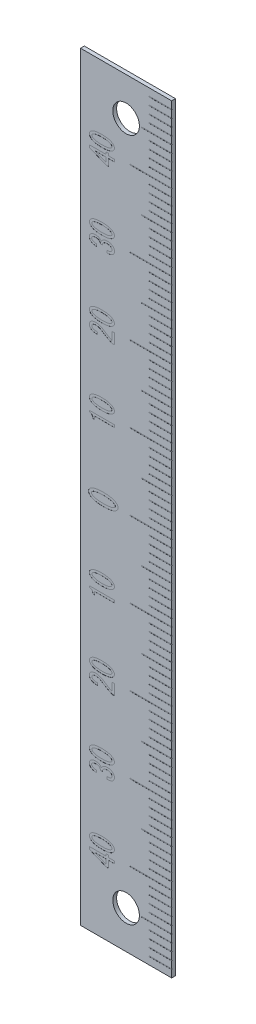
SolidWorks part; units mm, degrees
ref_plane "Front" through (0, 0, 0) normal (0, 0, 1) x (1, 0, 0)
ref_plane "Top" through (0, 0, 0) normal (0, 1, 0) x (1, 0, 0)
ref_plane "Right" through (0, 0, 0) normal (1, 0, 0) x (0, 0, -1)
sketch "Sketch1" plane through (0, 0, 0) normal (0, 0, 1) x (1, 0, 0)
  line L1 (0, 0) -> (0, 100)
  line L2 (0, 0) -> (12, 0)
  line L3 (12, 0) -> (12, 100)
  line L4 (0, 100) -> (12, 100)
  dimension "D1" = 100
  dimension "D2" = 12
extrude "Extrude1" add sketch "Sketch1" along normal blind 0.5
sketch "Sketch2" plane through (0, 0, 0.5) normal (0, 0, 1) x (1, 0, 0)
  line L0 (0, 100) -> (0, 0) construction
  line L1 (0, 0) -> (12, 0) construction
  line L2 (12, 100) -> (0, 100) construction
  circle A0 centre (6, 5) radius 1.75
  circle A1 centre (6, 95) radius 1.75
  dimension "D1" = 6
  dimension "D2" = 6
  dimension "D3" = 5
  dimension "D4" = 5
  dimension "D5" = 3.5
  dimension "D6" = 3.5
extrude "Extrude2" cut sketch "Sketch2" against normal through all
sketch "Sketch3" plane through (0, 0, 0.5) normal (0, 0, 1) x (1, 0, 0)
  line L0 (12, 100) -> (0, 100) construction
  line L1 (1, 88.25) -> (4.5, 88.25) construction
  line L2 (1, 88.25) -> (1, 91.75) construction
  line L3 (1, 91.75) -> (4.5, 91.75) construction
  line L4 (4.5, 88.25) -> (4.5, 91.75) construction
  line L5 (0, 100) -> (0, 0) construction
  line L6 (4.5, 78.25) -> (4.5, 81.75) construction
  line L7 (4.5, 68.25) -> (4.5, 71.75) construction
  line L8 (4.5, 58.25) -> (4.5, 61.75) construction
  line L9 (5, 49.125) -> (5, 52.625) construction
  line L10 (4.5, 38.25) -> (4.5, 41.75) construction
  line L11 (4.5, 28.25) -> (4.5, 31.75) construction
  line L12 (4.5, 18.25) -> (4.5, 21.75) construction
  line L13 (4.5, 8.25) -> (4.5, 11.75) construction
  line L14 (8.2751, 50) -> (-8.2751, 50) construction
  line L15 (8.2751, 40) -> (-8.2751, 40) construction
  line L16 (12, 0) -> (12, 100) construction
  line L17 (8.2751, 30) -> (-8.2751, 30) construction
  line L18 (8.2751, 20) -> (-8.2751, 20) construction
  line L19 (8.2751, 10) -> (-8.2751, 10) construction
  line L20 (8.2751, 60) -> (-8.2751, 60) construction
  line L21 (8.2751, 70) -> (-8.2751, 70) construction
  line L22 (8.2751, 80) -> (-8.2751, 80) construction
  line L23 (8.2751, 90) -> (-8.2751, 90) construction
  text T0 "40" font "ＭＳ ゴシック" height in points 11
  text T1 "30" font "ＭＳ ゴシック" height in points 11
  text T2 "20" font "ＭＳ ゴシック" height in points 11
  text T3 "10" font "ＭＳ ゴシック" height in points 11
  text T4 "0" font "ＭＳ ゴシック" height in points 13
  text T5 "10  " font "ＭＳ ゴシック" height in points 11
  text T6 "20" font "ＭＳ ゴシック" height in points 11
  text T7 "30" font "ＭＳ ゴシック" height in points 11
  text T8 "40" font "ＭＳ ゴシック" height in points 11
  point P4 (4.5, 90)
  point P36 (0, 50)
  dimension "D1" = 3.5
  dimension "D2" = 10
  dimension "D3" = 1
  dimension "D4" = 3.5
  dimension "D7" = 5
  dimension "D9" = 0.875
  dimension "D6" = 7
  dimension "D5" = 4
  dimension "D8" = 5
extrude "Extrude3" cut sketch "Sketch3" against normal blind 0.01
sketch "Sketch4" plane through (0, 0, 0.5) normal (0, 0, 1) x (1, 0, 0)
  line L0 (12, 90.05) -> (6.5, 90.05)
  line L1 (12, 0) -> (12, 100) construction
  line L2 (6.5, 90.05) -> (6.5, 89.95)
  line L3 (6.5, 89.95) -> (12, 89.95)
  line L4 (12, 89.95) -> (12, 90.05)
  line L5 (12, 100) -> (0, 100) construction
  line L6 (12, 98.05) -> (12, 97.95)
  line L7 (12, 94.95) -> (8, 94.95)
  line L8 (12, 94.95) -> (12, 95.05)
  line L9 (12, 95.05) -> (8, 95.05)
  line L10 (8, 94.95) -> (8, 95.05)
  line L11 (12, 99.05) -> (9, 99.05)
  line L12 (12, 99.05) -> (12, 98.95)
  line L13 (12, 98.95) -> (9, 98.95)
  line L14 (9, 99.05) -> (9, 98.95)
  line L15 (12, 98.05) -> (9, 98.05)
  line L16 (12, 97.95) -> (9, 97.95)
  line L17 (9, 98.05) -> (9, 97.95)
  line L18 (12, 97.05) -> (12, 96.95)
  line L19 (12, 97.05) -> (9, 97.05)
  line L20 (12, 96.95) -> (9, 96.95)
  line L21 (9, 97.05) -> (9, 96.95)
  line L22 (12, 96.05) -> (12, 95.95)
  line L23 (12, 96.05) -> (9, 96.05)
  line L24 (12, 95.95) -> (9, 95.95)
  line L25 (9, 96.05) -> (9, 95.95)
  line L26 (12, 80.05) -> (6.5, 80.05)
  line L27 (6.5, 80.05) -> (6.5, 79.95)
  line L28 (6.5, 79.95) -> (12, 79.95)
  line L29 (12, 79.95) -> (12, 80.05)
  line L30 (12, 94.05) -> (12, 93.95)
  line L31 (12, 94.05) -> (9, 94.05)
  line L32 (12, 93.95) -> (9, 93.95)
  line L33 (9, 94.05) -> (9, 93.95)
  line L34 (12, 93.05) -> (12, 92.95)
  line L35 (12, 93.05) -> (9, 93.05)
  line L36 (12, 92.95) -> (9, 92.95)
  line L37 (9, 93.05) -> (9, 92.95)
  line L38 (12, 92.05) -> (12, 91.95)
  line L39 (12, 92.05) -> (9, 92.05)
  line L40 (12, 91.95) -> (9, 91.95)
  line L41 (9, 92.05) -> (9, 91.95)
  line L42 (12, 91.05) -> (12, 90.95)
  line L43 (12, 91.05) -> (9, 91.05)
  line L44 (12, 90.95) -> (9, 90.95)
  line L45 (9, 91.05) -> (9, 90.95)
  line L46 (9, 95.05) -> (9, 94.95)
  line L47 (12, 95.05) -> (9, 95.05)
  line L48 (12, 94.95) -> (9, 94.95)
  line L49 (12, 95.05) -> (12, 94.95)
  line L50 (12, 88.05) -> (12, 87.95)
  line L51 (12, 84.95) -> (8, 84.95)
  line L52 (12, 84.95) -> (12, 85.05)
  line L53 (12, 85.05) -> (8, 85.05)
  line L54 (8, 84.95) -> (8, 85.05)
  line L55 (12, 89.05) -> (9, 89.05)
  line L56 (12, 89.05) -> (12, 88.95)
  line L57 (12, 88.95) -> (9, 88.95)
  line L58 (9, 89.05) -> (9, 88.95)
  line L59 (12, 88.05) -> (9, 88.05)
  line L60 (12, 87.95) -> (9, 87.95)
  line L61 (9, 88.05) -> (9, 87.95)
  line L62 (12, 87.05) -> (12, 86.95)
  line L63 (12, 87.05) -> (9, 87.05)
  line L64 (12, 86.95) -> (9, 86.95)
  line L65 (9, 87.05) -> (9, 86.95)
  line L66 (12, 86.05) -> (12, 85.95)
  line L67 (12, 86.05) -> (9, 86.05)
  line L68 (12, 85.95) -> (9, 85.95)
  line L69 (9, 86.05) -> (9, 85.95)
  line L70 (12, 84.05) -> (12, 83.95)
  line L71 (12, 84.05) -> (9, 84.05)
  line L72 (12, 83.95) -> (9, 83.95)
  line L73 (9, 84.05) -> (9, 83.95)
  line L74 (12, 83.05) -> (12, 82.95)
  line L75 (12, 83.05) -> (9, 83.05)
  line L76 (12, 82.95) -> (9, 82.95)
  line L77 (9, 83.05) -> (9, 82.95)
  line L78 (12, 82.05) -> (12, 81.95)
  line L79 (12, 82.05) -> (9, 82.05)
  line L80 (12, 81.95) -> (9, 81.95)
  line L81 (9, 82.05) -> (9, 81.95)
  line L82 (12, 81.05) -> (12, 80.95)
  line L83 (12, 81.05) -> (9, 81.05)
  line L84 (12, 80.95) -> (9, 80.95)
  line L85 (9, 81.05) -> (9, 80.95)
  line L86 (12, 70.05) -> (6.5, 70.05)
  line L87 (6.5, 70.05) -> (6.5, 69.95)
  line L88 (6.5, 69.95) -> (12, 69.95)
  line L89 (12, 69.95) -> (12, 70.05)
  line L90 (12, 78.05) -> (12, 77.95)
  line L91 (12, 74.95) -> (8, 74.95)
  line L92 (12, 74.95) -> (12, 75.05)
  line L93 (12, 75.05) -> (8, 75.05)
  line L94 (8, 74.95) -> (8, 75.05)
  line L95 (12, 79.05) -> (9, 79.05)
  line L96 (12, 79.05) -> (12, 78.95)
  line L97 (12, 78.95) -> (9, 78.95)
  line L98 (9, 79.05) -> (9, 78.95)
  line L99 (12, 78.05) -> (9, 78.05)
  line L100 (12, 77.95) -> (9, 77.95)
  line L101 (9, 78.05) -> (9, 77.95)
  line L102 (12, 77.05) -> (12, 76.95)
  line L103 (12, 77.05) -> (9, 77.05)
  line L104 (12, 76.95) -> (9, 76.95)
  line L105 (9, 77.05) -> (9, 76.95)
  line L106 (12, 76.05) -> (12, 75.95)
  line L107 (12, 76.05) -> (9, 76.05)
  line L108 (12, 75.95) -> (9, 75.95)
  line L109 (9, 76.05) -> (9, 75.95)
  line L110 (12, 74.05) -> (12, 73.95)
  line L111 (12, 74.05) -> (9, 74.05)
  line L112 (12, 73.95) -> (9, 73.95)
  line L113 (9, 74.05) -> (9, 73.95)
  line L114 (12, 73.05) -> (12, 72.95)
  line L115 (12, 73.05) -> (9, 73.05)
  line L116 (12, 72.95) -> (9, 72.95)
  line L117 (9, 73.05) -> (9, 72.95)
  line L118 (12, 72.05) -> (12, 71.95)
  line L119 (12, 72.05) -> (9, 72.05)
  line L120 (12, 71.95) -> (9, 71.95)
  line L121 (9, 72.05) -> (9, 71.95)
  line L122 (12, 71.05) -> (12, 70.95)
  line L123 (12, 71.05) -> (9, 71.05)
  line L124 (12, 70.95) -> (9, 70.95)
  line L125 (9, 71.05) -> (9, 70.95)
  line L126 (12, 60.05) -> (6.5, 60.05)
  line L127 (6.5, 60.05) -> (6.5, 59.95)
  line L128 (6.5, 59.95) -> (12, 59.95)
  line L129 (12, 59.95) -> (12, 60.05)
  line L130 (12, 68.05) -> (12, 67.95)
  line L131 (12, 64.95) -> (8, 64.95)
  line L132 (12, 64.95) -> (12, 65.05)
  line L133 (12, 65.05) -> (8, 65.05)
  line L134 (8, 64.95) -> (8, 65.05)
  line L135 (12, 69.05) -> (9, 69.05)
  line L136 (12, 69.05) -> (12, 68.95)
  line L137 (12, 68.95) -> (9, 68.95)
  line L138 (9, 69.05) -> (9, 68.95)
  line L139 (12, 68.05) -> (9, 68.05)
  line L140 (12, 67.95) -> (9, 67.95)
  line L141 (9, 68.05) -> (9, 67.95)
  line L142 (12, 67.05) -> (12, 66.95)
  line L143 (12, 67.05) -> (9, 67.05)
  line L144 (12, 66.95) -> (9, 66.95)
  line L145 (9, 67.05) -> (9, 66.95)
  line L146 (12, 66.05) -> (12, 65.95)
  line L147 (12, 66.05) -> (9, 66.05)
  line L148 (12, 65.95) -> (9, 65.95)
  line L149 (9, 66.05) -> (9, 65.95)
  line L150 (12, 64.05) -> (12, 63.95)
  line L151 (12, 64.05) -> (9, 64.05)
  line L152 (12, 63.95) -> (9, 63.95)
  line L153 (9, 64.05) -> (9, 63.95)
  line L154 (12, 63.05) -> (12, 62.95)
  line L155 (12, 63.05) -> (9, 63.05)
  line L156 (12, 62.95) -> (9, 62.95)
  line L157 (9, 63.05) -> (9, 62.95)
  line L158 (12, 62.05) -> (12, 61.95)
  line L159 (12, 62.05) -> (9, 62.05)
  line L160 (12, 61.95) -> (9, 61.95)
  line L161 (9, 62.05) -> (9, 61.95)
  line L162 (12, 61.05) -> (12, 60.95)
  line L163 (12, 61.05) -> (9, 61.05)
  line L164 (12, 60.95) -> (9, 60.95)
  line L165 (9, 61.05) -> (9, 60.95)
  line L166 (12, 50.05) -> (6.5, 50.05)
  line L167 (6.5, 50.05) -> (6.5, 49.95)
  line L168 (6.5, 49.95) -> (12, 49.95)
  line L169 (12, 49.95) -> (12, 50.05)
  line L170 (12, 58.05) -> (12, 57.95)
  line L171 (12, 54.95) -> (8, 54.95)
  line L172 (12, 54.95) -> (12, 55.05)
  line L173 (12, 55.05) -> (8, 55.05)
  line L174 (8, 54.95) -> (8, 55.05)
  line L175 (12, 59.05) -> (9, 59.05)
  line L176 (12, 59.05) -> (12, 58.95)
  line L177 (12, 58.95) -> (9, 58.95)
  line L178 (9, 59.05) -> (9, 58.95)
  line L179 (12, 58.05) -> (9, 58.05)
  line L180 (12, 57.95) -> (9, 57.95)
  line L181 (9, 58.05) -> (9, 57.95)
  line L182 (12, 57.05) -> (12, 56.95)
  line L183 (12, 57.05) -> (9, 57.05)
  line L184 (12, 56.95) -> (9, 56.95)
  line L185 (9, 57.05) -> (9, 56.95)
  line L186 (12, 56.05) -> (12, 55.95)
  line L187 (12, 56.05) -> (9, 56.05)
  line L188 (12, 55.95) -> (9, 55.95)
  line L189 (9, 56.05) -> (9, 55.95)
  line L190 (12, 54.05) -> (12, 53.95)
  line L191 (12, 54.05) -> (9, 54.05)
  line L192 (12, 53.95) -> (9, 53.95)
  line L193 (9, 54.05) -> (9, 53.95)
  line L194 (12, 53.05) -> (12, 52.95)
  line L195 (12, 53.05) -> (9, 53.05)
  line L196 (12, 52.95) -> (9, 52.95)
  line L197 (9, 53.05) -> (9, 52.95)
  line L198 (12, 52.05) -> (12, 51.95)
  line L199 (12, 52.05) -> (9, 52.05)
  line L200 (12, 51.95) -> (9, 51.95)
  line L201 (9, 52.05) -> (9, 51.95)
  line L202 (12, 51.05) -> (12, 50.95)
  line L203 (12, 51.05) -> (9, 51.05)
  line L204 (12, 50.95) -> (9, 50.95)
  line L205 (9, 51.05) -> (9, 50.95)
  line L206 (12, 50.05) -> (6.5, 50.05)
  line L207 (6.5, 50.05) -> (6.5, 49.95)
  line L208 (6.5, 49.95) -> (12, 49.95)
  line L209 (12, 49.95) -> (12, 50.05)
  line L210 (12, 48.05) -> (12, 47.95)
  line L211 (12, 44.95) -> (8, 44.95)
  line L212 (12, 44.95) -> (12, 45.05)
  line L213 (12, 45.05) -> (8, 45.05)
  line L214 (8, 44.95) -> (8, 45.05)
  line L215 (12, 49.05) -> (9, 49.05)
  line L216 (12, 49.05) -> (12, 48.95)
  line L217 (12, 48.95) -> (9, 48.95)
  line L218 (9, 49.05) -> (9, 48.95)
  line L219 (12, 48.05) -> (9, 48.05)
  line L220 (12, 47.95) -> (9, 47.95)
  line L221 (9, 48.05) -> (9, 47.95)
  line L222 (12, 47.05) -> (12, 46.95)
  line L223 (12, 47.05) -> (9, 47.05)
  line L224 (12, 46.95) -> (9, 46.95)
  line L225 (9, 47.05) -> (9, 46.95)
  line L226 (12, 46.05) -> (12, 45.95)
  line L227 (12, 46.05) -> (9, 46.05)
  line L228 (12, 45.95) -> (9, 45.95)
  line L229 (9, 46.05) -> (9, 45.95)
  line L230 (12, 44.05) -> (12, 43.95)
  line L231 (12, 44.05) -> (9, 44.05)
  line L232 (12, 43.95) -> (9, 43.95)
  line L233 (9, 44.05) -> (9, 43.95)
  line L234 (12, 43.05) -> (12, 42.95)
  line L235 (12, 43.05) -> (9, 43.05)
  line L236 (12, 42.95) -> (9, 42.95)
  line L237 (9, 43.05) -> (9, 42.95)
  line L238 (12, 42.05) -> (12, 41.95)
  line L239 (12, 42.05) -> (9, 42.05)
  line L240 (12, 41.95) -> (9, 41.95)
  line L241 (9, 42.05) -> (9, 41.95)
  line L242 (12, 41.05) -> (12, 40.95)
  line L243 (12, 41.05) -> (9, 41.05)
  line L244 (12, 40.95) -> (9, 40.95)
  line L245 (9, 41.05) -> (9, 40.95)
  line L246 (12, 40.05) -> (6.5, 40.05)
  line L247 (6.5, 40.05) -> (6.5, 39.95)
  line L248 (6.5, 39.95) -> (12, 39.95)
  line L249 (12, 39.95) -> (12, 40.05)
  line L250 (12, 38.05) -> (12, 37.95)
  line L251 (12, 34.95) -> (8, 34.95)
  line L252 (12, 34.95) -> (12, 35.05)
  line L253 (12, 35.05) -> (8, 35.05)
  line L254 (8, 34.95) -> (8, 35.05)
  line L255 (12, 39.05) -> (9, 39.05)
  line L256 (12, 39.05) -> (12, 38.95)
  line L257 (12, 38.95) -> (9, 38.95)
  line L258 (9, 39.05) -> (9, 38.95)
  line L259 (12, 38.05) -> (9, 38.05)
  line L260 (12, 37.95) -> (9, 37.95)
  line L261 (9, 38.05) -> (9, 37.95)
  line L262 (12, 37.05) -> (12, 36.95)
  line L263 (12, 37.05) -> (9, 37.05)
  line L264 (12, 36.95) -> (9, 36.95)
  line L265 (9, 37.05) -> (9, 36.95)
  line L266 (12, 36.05) -> (12, 35.95)
  line L267 (12, 36.05) -> (9, 36.05)
  line L268 (12, 35.95) -> (9, 35.95)
  line L269 (9, 36.05) -> (9, 35.95)
  line L270 (12, 34.05) -> (12, 33.95)
  line L271 (12, 34.05) -> (9, 34.05)
  line L272 (12, 33.95) -> (9, 33.95)
  line L273 (9, 34.05) -> (9, 33.95)
  line L274 (12, 33.05) -> (12, 32.95)
  line L275 (12, 33.05) -> (9, 33.05)
  line L276 (12, 32.95) -> (9, 32.95)
  line L277 (9, 33.05) -> (9, 32.95)
  line L278 (12, 32.05) -> (12, 31.95)
  line L279 (12, 32.05) -> (9, 32.05)
  line L280 (12, 31.95) -> (9, 31.95)
  line L281 (9, 32.05) -> (9, 31.95)
  line L282 (12, 31.05) -> (12, 30.95)
  line L283 (12, 31.05) -> (9, 31.05)
  line L284 (12, 30.95) -> (9, 30.95)
  line L285 (9, 31.05) -> (9, 30.95)
  line L286 (12, 30.05) -> (6.5, 30.05)
  line L287 (6.5, 30.05) -> (6.5, 29.95)
  line L288 (6.5, 29.95) -> (12, 29.95)
  line L289 (12, 29.95) -> (12, 30.05)
  line L290 (12, 28.05) -> (12, 27.95)
  line L291 (12, 24.95) -> (8, 24.95)
  line L292 (12, 24.95) -> (12, 25.05)
  line L293 (12, 25.05) -> (8, 25.05)
  line L294 (8, 24.95) -> (8, 25.05)
  line L295 (12, 29.05) -> (9, 29.05)
  line L296 (12, 29.05) -> (12, 28.95)
  line L297 (12, 28.95) -> (9, 28.95)
  line L298 (9, 29.05) -> (9, 28.95)
  line L299 (12, 28.05) -> (9, 28.05)
  line L300 (12, 27.95) -> (9, 27.95)
  line L301 (9, 28.05) -> (9, 27.95)
  line L302 (12, 27.05) -> (12, 26.95)
  line L303 (12, 27.05) -> (9, 27.05)
  line L304 (12, 26.95) -> (9, 26.95)
  line L305 (9, 27.05) -> (9, 26.95)
  line L306 (12, 26.05) -> (12, 25.95)
  line L307 (12, 26.05) -> (9, 26.05)
  line L308 (12, 25.95) -> (9, 25.95)
  line L309 (9, 26.05) -> (9, 25.95)
  line L310 (12, 24.05) -> (12, 23.95)
  line L311 (12, 24.05) -> (9, 24.05)
  line L312 (12, 23.95) -> (9, 23.95)
  line L313 (9, 24.05) -> (9, 23.95)
  line L314 (12, 23.05) -> (12, 22.95)
  line L315 (12, 23.05) -> (9, 23.05)
  line L316 (12, 22.95) -> (9, 22.95)
  line L317 (9, 23.05) -> (9, 22.95)
  line L318 (12, 22.05) -> (12, 21.95)
  line L319 (12, 22.05) -> (9, 22.05)
  line L320 (12, 21.95) -> (9, 21.95)
  line L321 (9, 22.05) -> (9, 21.95)
  line L322 (12, 21.05) -> (12, 20.95)
  line L323 (12, 21.05) -> (9, 21.05)
  line L324 (12, 20.95) -> (9, 20.95)
  line L325 (9, 21.05) -> (9, 20.95)
  line L326 (12, 20.05) -> (6.5, 20.05)
  line L327 (6.5, 20.05) -> (6.5, 19.95)
  line L328 (6.5, 19.95) -> (12, 19.95)
  line L329 (12, 19.95) -> (12, 20.05)
  line L330 (12, 18.05) -> (12, 17.95)
  line L331 (12, 14.95) -> (8, 14.95)
  line L332 (12, 14.95) -> (12, 15.05)
  line L333 (12, 15.05) -> (8, 15.05)
  line L334 (8, 14.95) -> (8, 15.05)
  line L335 (12, 19.05) -> (9, 19.05)
  line L336 (12, 19.05) -> (12, 18.95)
  line L337 (12, 18.95) -> (9, 18.95)
  line L338 (9, 19.05) -> (9, 18.95)
  line L339 (12, 18.05) -> (9, 18.05)
  line L340 (12, 17.95) -> (9, 17.95)
  line L341 (9, 18.05) -> (9, 17.95)
  line L342 (12, 17.05) -> (12, 16.95)
  line L343 (12, 17.05) -> (9, 17.05)
  line L344 (12, 16.95) -> (9, 16.95)
  line L345 (9, 17.05) -> (9, 16.95)
  line L346 (12, 16.05) -> (12, 15.95)
  line L347 (12, 16.05) -> (9, 16.05)
  line L348 (12, 15.95) -> (9, 15.95)
  line L349 (9, 16.05) -> (9, 15.95)
  line L350 (12, 14.05) -> (12, 13.95)
  line L351 (12, 14.05) -> (9, 14.05)
  line L352 (12, 13.95) -> (9, 13.95)
  line L353 (9, 14.05) -> (9, 13.95)
  line L354 (12, 13.05) -> (12, 12.95)
  line L355 (12, 13.05) -> (9, 13.05)
  line L356 (12, 12.95) -> (9, 12.95)
  line L357 (9, 13.05) -> (9, 12.95)
  line L358 (12, 12.05) -> (12, 11.95)
  line L359 (12, 12.05) -> (9, 12.05)
  line L360 (12, 11.95) -> (9, 11.95)
  line L361 (9, 12.05) -> (9, 11.95)
  line L362 (12, 11.05) -> (12, 10.95)
  line L363 (12, 11.05) -> (9, 11.05)
  line L364 (12, 10.95) -> (9, 10.95)
  line L365 (9, 11.05) -> (9, 10.95)
  line L366 (12, 10.05) -> (6.5, 10.05)
  line L367 (6.5, 10.05) -> (6.5, 9.95)
  line L368 (6.5, 9.95) -> (12, 9.95)
  line L369 (12, 9.95) -> (12, 10.05)
  line L370 (12, 8.05) -> (12, 7.95)
  line L371 (12, 4.95) -> (8, 4.95)
  line L372 (12, 4.95) -> (12, 5.05)
  line L373 (12, 5.05) -> (8, 5.05)
  line L374 (8, 4.95) -> (8, 5.05)
  line L375 (12, 9.05) -> (9, 9.05)
  line L376 (12, 9.05) -> (12, 8.95)
  line L377 (12, 8.95) -> (9, 8.95)
  line L378 (9, 9.05) -> (9, 8.95)
  line L379 (12, 8.05) -> (9, 8.05)
  line L380 (12, 7.95) -> (9, 7.95)
  line L381 (9, 8.05) -> (9, 7.95)
  line L382 (12, 7.05) -> (12, 6.95)
  line L383 (12, 7.05) -> (9, 7.05)
  line L384 (12, 6.95) -> (9, 6.95)
  line L385 (9, 7.05) -> (9, 6.95)
  line L386 (12, 6.05) -> (12, 5.95)
  line L387 (12, 6.05) -> (9, 6.05)
  line L388 (12, 5.95) -> (9, 5.95)
  line L389 (9, 6.05) -> (9, 5.95)
  line L390 (12, 4.05) -> (12, 3.95)
  line L391 (12, 4.05) -> (9, 4.05)
  line L392 (12, 3.95) -> (9, 3.95)
  line L393 (9, 4.05) -> (9, 3.95)
  line L394 (12, 3.05) -> (12, 2.95)
  line L395 (12, 3.05) -> (9, 3.05)
  line L396 (12, 2.95) -> (9, 2.95)
  line L397 (9, 3.05) -> (9, 2.95)
  line L398 (12, 2.05) -> (12, 1.95)
  line L399 (12, 2.05) -> (9, 2.05)
  line L400 (12, 1.95) -> (9, 1.95)
  line L401 (9, 2.05) -> (9, 1.95)
  line L402 (12, 1.05) -> (12, 0.95)
  line L403 (12, 1.05) -> (9, 1.05)
  line L404 (12, 0.95) -> (9, 0.95)
  line L405 (9, 1.05) -> (9, 0.95)
  point P4 (12, 90)
  point P13 (12, 95)
  point P18 (12, 99)
  dimension "D1" = 10
  dimension "D2" = 0.1
  dimension "D3" = 5.5
  dimension "D4" = 5
  dimension "D5" = 0.1
  dimension "D6" = 1
  dimension "D7" = 0.1
  dimension "D8" = 3
  dimension "D9" = 4
  dimension "D10" = 9
  dimension "D11" = 5
  dimension "D12" = 6
extrude "Extrude4" cut sketch "Sketch4" against normal blind 0.01
move or copy body "Body-Move/Copy2" bodies to move or copy 105 copy no translate (-12, -50, 0)
